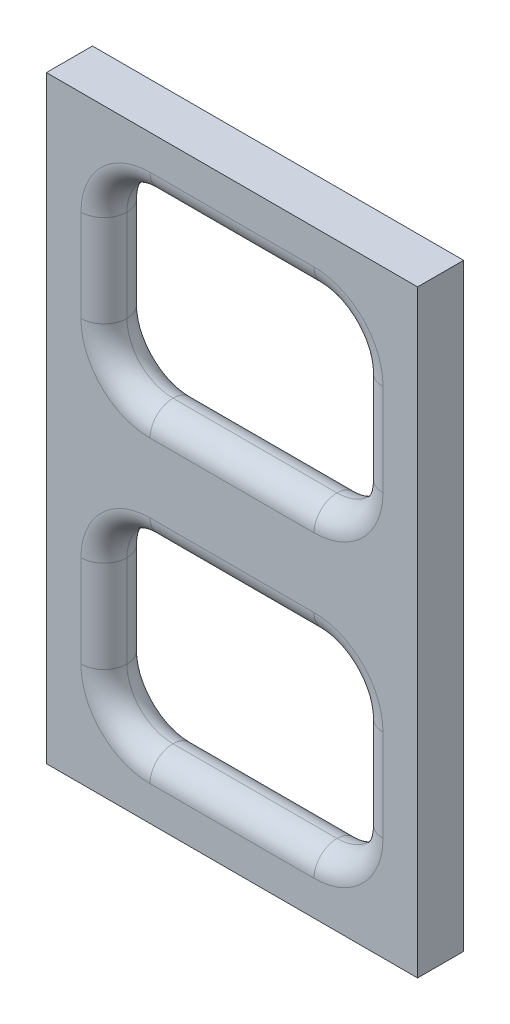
SolidWorks part; units mm, degrees
ref_plane "Спереди" through (0, 0, 0) normal (0, 0, 1) x (1, 0, 0)
ref_plane "Сверху" through (0, 0, 0) normal (0, 1, 0) x (1, 0, 0)
ref_plane "Справа" through (0, 0, 0) normal (1, 0, 0) x (0, 0, -1)
sketch "Эскиз1" plane through (0, 0, 0) normal (0, 0, 1) x (1, 0, 0)
  line L0 (-28.5, 84) -> (28.5, 84)
  line L1 (-64.5, 104) -> (64.5, 104)
  line L2 (-64.5, 104) -> (-64.5, -104)
  line L3 (-64.5, -104) -> (64.5, -104)
  line L4 (64.5, 104) -> (64.5, -104)
  line L5 (-64.5, 104) -> (64.5, -104) construction
  line L6 (-64.5, -104) -> (64.5, 104) construction
  line L7 (44.5, 68) -> (44.5, 36)
  line L8 (-28.5, -84) -> (28.5, -84)
  line L9 (-44.5, 68) -> (-44.5, 36)
  line L10 (-28.5, 20) -> (28.5, 20)
  line L11 (-28.5, -20) -> (28.5, -20)
  line L12 (-44.5, -36) -> (-44.5, -68)
  line L13 (44.5, -36) -> (44.5, -68)
  line L14 (-44.5, 84) -> (-44.5, -84) construction
  line L15 (-44.5, -84) -> (44.5, -84) construction
  line L16 (44.5, 84) -> (44.5, -84) construction
  line L17 (-44.5, 84) -> (44.5, 84) construction
  arc A0 (44.5, -68) -> (28.5, -84) centre (28.5, -68) cw
  arc A1 (-28.5, -84) -> (-44.5, -68) centre (-28.5, -68) cw
  arc A2 (-28.5, -20) -> (-44.5, -36) centre (-28.5, -36) ccw
  arc A3 (28.5, -20) -> (44.5, -36) centre (28.5, -36) cw
  arc A4 (28.5, 20) -> (44.5, 36) centre (28.5, 36) ccw
  arc A5 (28.5, 84) -> (44.5, 68) centre (28.5, 68) cw
  arc A6 (-28.5, 84) -> (-44.5, 68) centre (-28.5, 68) ccw
  arc A7 (-28.5, 20) -> (-44.5, 36) centre (-28.5, 36) cw
  point P0 (0, 0)
  point P22 (-44.5, -20)
  point P25 (44.5, -20)
  dimension "D2" = 16
  dimension "D1" = 20
extrude "Бобышка-Вытянуть1" add sketch "Эскиз1" along normal blind 16
fillet "Скругление1" radius 8 32 edges at (-39.8137, -24.6863, 0) (0, -20, 0) (39.8137, -24.6863, 0) (44.5, -52, 0) (39.8137, -79.3137, 0) (0, -84, 0) (-39.8137, -79.3137, 0) (-39.8137, 79.3137, 0) (0, 84, 0) (39.8137, 79.3137, 0) (44.5, 52, 0) (39.8137, 24.6863, 0) (0, 20, 0) (-39.8137, 24.6863, 0) (-39.8137, -24.6863, 16) (0, -20, 16) (39.8137, -24.6863, 16) (44.5, -52, 16) (39.8137, -79.3137, 16) (0, -84, 16) (-39.8137, -79.3137, 16) (-39.8137, 79.3137, 16) (0, 84, 16) (39.8137, 79.3137, 16) (44.5, 52, 16) (39.8137, 24.6863, 16) (0, 20, 16) (-39.8137, 24.6863, 16) (-44.5, -52, 0) (-44.5, 52, 0) (-44.5, -52, 16) (-44.5, 52, 16)
